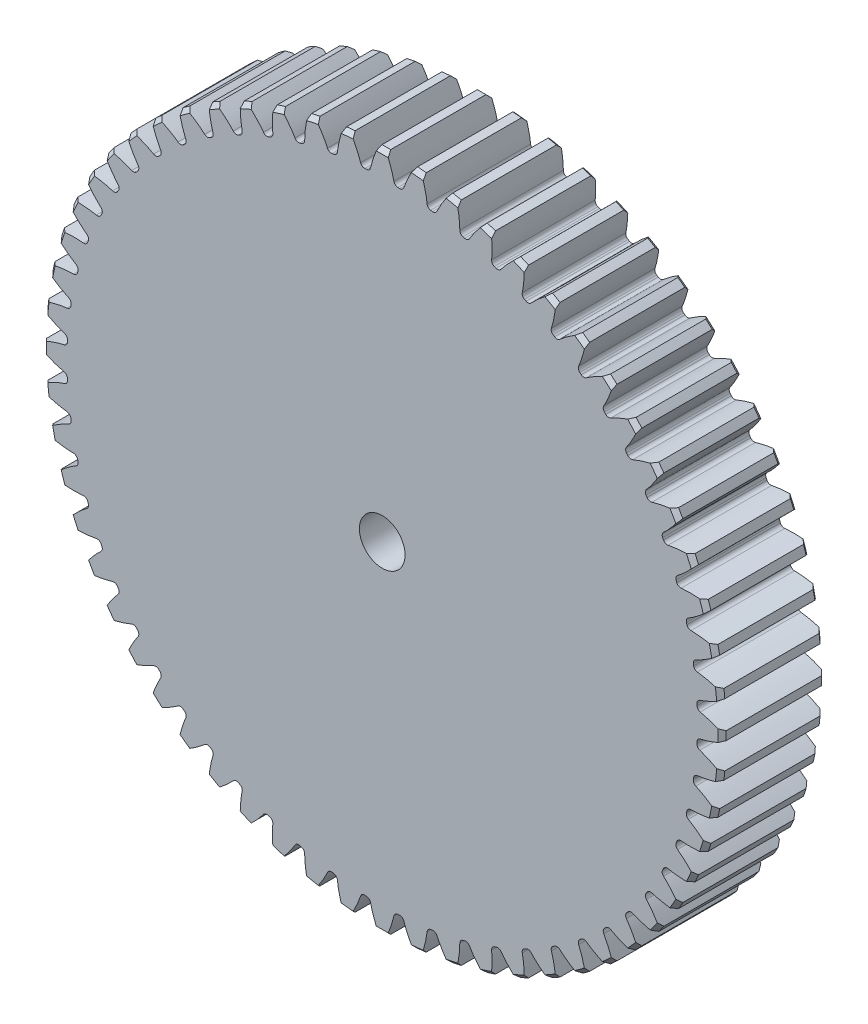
SolidWorks part; units mm, degrees
ref_plane "Face" through (0, 0, 0) normal (0, 0, 1) x (1, 0, 0)
ref_plane "Dessus" through (0, 0, 0) normal (0, 1, 0) x (1, 0, 0)
ref_plane "Droite" through (0, 0, 0) normal (1, 0, 0) x (0, 0, -1)
sketch "Dent" plane through (0, 0, 0) normal (0, 0, 1) x (1, 0, 0)
  line L1 (-0.1414, 9.1211) -> (0, 8.7325)
  line L3 (0, 11.16) -> (0, -11.16) construction
  line L4 (0, 0) -> (0.1414, 11.1591) construction
  line L5 (0.2827, 10.7963) -> (-0.2827, 10.7963) construction
  line L6 (0.4169, 10.1401) -> (-0.4169, 10.1401) construction
  line L7 (-0.18, 0) -> (0.18, 0) construction
  line L9 (0.1414, 9.1211) -> (0, 8.7325)
  line L11 (0, 0) -> (0.2827, 10.7963) construction
  line L12 (0, 0) -> (0.4169, 10.1401) construction
  circle A0 centre (0, 0) radius 10.8 construction
  circle A1 centre (0, 0) radius 11.16 construction
  arc A2 (0.1414, 11.1591) -> (-0.1414, 11.1591) centre (0, 0) ccw
  circle A3 centre (0, 0) radius 10.1487 construction
  point P2 (-0.2827, 10.7963)
  point P3 (-0.4169, 10.1401)
  point P19 (0.2827, 10.7963)
  point P20 (0.4169, 10.1401)
  dimension "Dp" = 21.6
  dimension "Dt" = 22.32
  dimension "Db" = 20.2974
  dimension "Module" = 0.36
  dimension "Angle de pression" = 20
  dimension "Ep au primitif" = 0.5655
  dimension "D3" = 1.628
  dimension "D4" = 0.854
sketch "Esquisse2" plane through (0, 0, 0) normal (0, 0, 1) x (1, 0, 0)
  circle A0 centre (0, 0) radius 10.35
  dimension "D1" = 20.7
extrude "Base-Extrusion" add sketch "Esquisse2" against normal mid plane 3.4
extrude "Boss.-Extru.1" add sketch "Dent" against normal mid plane 3.4
fillet "Congé1" radius 0.1368 4 edges at (0.4021, 10.3422, 0) (-0.4024, 10.3422, 0)
chamfer "Chanfrein1" distance 0.1368 angle 45 4 edges at (0, 11.16, -1.7) (0, 11.16, 1.7)
pattern_circular "Répétition circulaire1" count 60 over 360 of "Congé1", "Boss.-Extru.1", "Chanfrein1"
sketch "Esquisse3" plane through (0, 0, -1.7) normal (0, 0, -1) x (-1, 0, 0)
  line L0 (0, 0) -> (0, 6.675) construction
  line L1 (-1.5, 5.1875) -> (-1.5, 2.3643)
  line L2 (1.5, 5.1875) -> (1.5, 2.3643)
  arc A0 (-1.5, 5.1875) -> (1.5, 5.1875) centre (0, 0) ccw
  arc A1 (-1.5, 2.3643) -> (1.5, 2.3643) centre (0, 0) ccw
  dimension "D1" = 10.8
  dimension "D2" = 5.6
  dimension "D3" = 3
extrude "Enlèv. mat.-Extru.1" cut sketch "Esquisse3" against normal blind 1.4
sketch "Esquisse4" plane through (0, 0, -1.7) normal (0, 0, -1) x (-1, 0, 0)
  line L0 (-1.5, 2.3643) -> (-1.5, 5.1875) construction
  line L1 (-1.5, 2.3643) -> (-1.5, 5.1875)
  line L2 (1.5, 5.1875) -> (1.5, 2.3643) construction
  line L3 (1.5, 5.1875) -> (1.5, 2.3643)
  arc A0 (1.5, 2.3643) -> (-1.5, 2.3643) centre (0, 0) ccw
  arc A1 (1.5, 5.1875) -> (-1.5, 5.1875) centre (0, 0) ccw
  arc A2 (-1.5, 5.1875) -> (1.5, 5.1875) centre (0, 0) ccw construction
  arc A3 (-1.5, 2.3643) -> (1.5, 2.3643) centre (0, 0) ccw construction
extrude "Enlèv. mat.-Extru.2" cut sketch "Esquisse4" against normal blind 0.4
sketch "Esquisse5" plane through (0, 0, -1.7) normal (0, 0, -1) x (-1, 0, 0)
  circle A0 centre (0, 0) radius 1.25
  dimension "D1" = 2.5
extrude "Boss.-Extru.2" add sketch "Esquisse5" along normal blind 2.8
sketch "Esquisse6" plane through (0, 0, 1.7) normal (0, 0, 1) x (1, 0, 0)
  circle A0 centre (0, 0) radius 0.75
  dimension "D1" = 1.5
extrude "Enlèv. mat.-Extru.3" cut sketch "Esquisse6" against normal up to next
sketch "Diamètre primitif roue" plane through (0, 0, 0) normal (0, 0, 1) x (1, 0, 0)
  circle A0 centre (0, 0) radius 10.8
  dimension "D1" = 21.6
